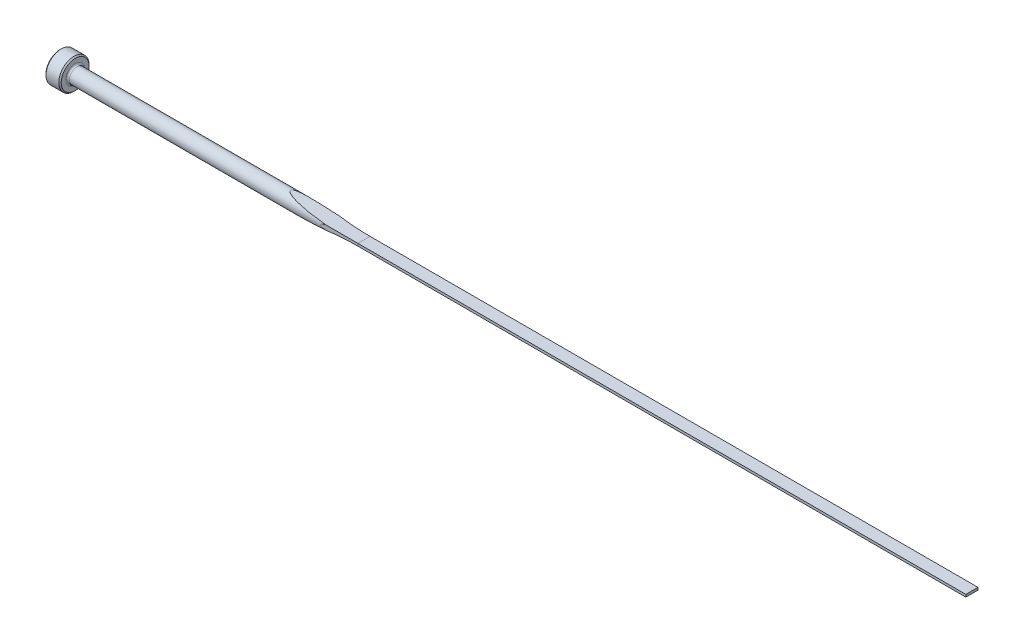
SolidWorks part; units mm, degrees
ref_plane "Front Plane" through (0, 0, 0) normal (0, 0, 1) x (1, 0, 0)
ref_plane "Top Plane" through (0, 0, 0) normal (0, 1, 0) x (1, 0, 0)
ref_plane "Right Plane" through (0, 0, 0) normal (1, 0, 0) x (0, 0, -1)
sketch "Sketch1" plane through (0, 0, 0) normal (0, 0, 1) x (1, 0, 0)
  line L0 (0, 0) -> (167.7268, 0) construction
  line L1 (0, 0) -> (0, 3.175)
  line L2 (0, 3.175) -> (3.175, 3.175)
  line L3 (3.175, 3.175) -> (3.175, 1.5875)
  line L4 (3.175, 1.5875) -> (190.5, 1.5875)
  line L5 (190.5, 1.5875) -> (190.5, 0)
  line L6 (190.5, 0) -> (0, 0)
  dimension "D1" = 190.5
  dimension "D2" = 6.35
  dimension "D3" = 3.175
  dimension "D4" = 3.175
revolve "Revolve1" add sketch "Sketch1" angle 360 about L0
sketch "Sketch2" plane through (0, 0, 0) normal (0, 0, 1) x (1, 0, 0)
  line L0 (190.5, 1.5875) -> (190.5, 0.254)
  line L1 (190.5, -1.5875) -> (190.5, 1.5875) construction
  line L2 (190.5, 0.254) -> (63.5, 0.254)
  line L3 (190.5, 1.5875) -> (3.175, 1.5875) construction
  line L4 (48.1599, 1.5875) -> (190.5, 1.5875)
  line L5 (166.0833, 0) -> (153.1705, 0) construction
  arc A0 (63.5, 0.254) -> (48.1599, 1.5875) centre (63.5, 89.154) cw
  dimension "D1" = 88.9
  dimension "D3" = 127
  dimension "D2" = 0.508
  dimension "D4" = 15.3401
extrude "Cut-Extrude1" cut sketch "Sketch2" against normal through all both and the other way through all
mirror "Mirror1" about plane through (0, 0, 0) normal (0, 1, 0) of "Cut-Extrude1"
sketch "Sketch3" plane through (0, 0, 0) normal (0, 1, 0) x (1, 0, 0)
  line L0 (190.5, 1.5875) -> (190.5, 1.27)
  line L1 (190.5, 1.567) -> (190.5, -1.567) construction
  line L2 (190.5, 1.27) -> (63.5, 1.27)
  line L3 (190.5, 1.5875) -> (3.175, 1.5875) construction
  line L4 (55.9933, 1.5875) -> (190.5, 1.5875)
  line L5 (163.4716, 0) -> (166.2513, 0) construction
  line L6 (63.5, 1.567) -> (63.5, -1.567) construction
  arc A0 (63.5, 1.27) -> (55.9933, 1.5875) centre (63.5, 90.17) cw
  dimension "D2" = 88.9
  dimension "D1" = 2.54
extrude "Cut-Extrude2" cut sketch "Sketch3" against normal through all both and the other way through all
mirror "Mirror2" about plane through (0, 0, 0) normal (0, 0, 1) of "Cut-Extrude2"
fillet "Fillet1" radius 0.381 1 edges at (3.175, 0, 1.5875)
chamfer "Chamfer1" distance 0.254 angle 45 2 edges at (0, 0, 3.175) (3.175, 0, 3.175)
